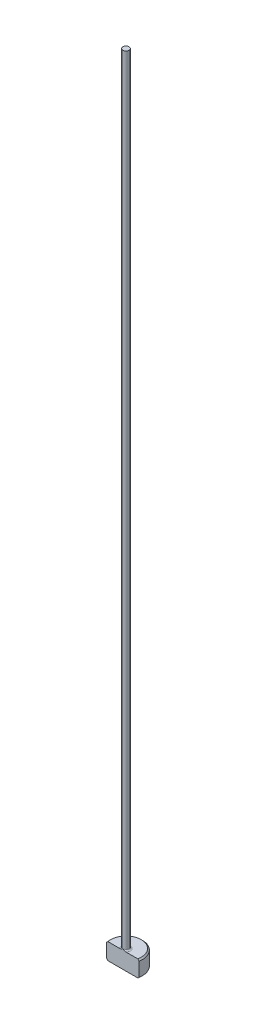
SolidWorks part; units mm, degrees
ref_plane "Front Plane" through (0, 0, 0) normal (0, 0, 1) x (1, 0, 0)
ref_plane "Top Plane" through (0, 0, 0) normal (0, 1, 0) x (1, 0, 0)
ref_plane "Right Plane" through (0, 0, 0) normal (1, 0, 0) x (0, 0, -1)
sketch "Sketch1" plane through (0, 0, 0) normal (0, 0, 1) x (1, 0, 0)
  line L0 (0, 259.9588) -> (0, -15.1925) construction
  line L1 (0, 0) -> (-3.175, 0)
  line L2 (-3.175, 0) -> (-3.175, 3.175)
  line L3 (-3.175, 3.175) -> (-0.5944, 3.175)
  line L4 (-0.5944, 3.175) -> (-0.5944, 152.4)
  line L5 (-0.5944, 152.4) -> (0, 152.4)
  line L6 (0, 152.4) -> (0, 0)
  dimension "L" = 152.4
  dimension "H" = 6.35
  dimension "T" = 3.175
  dimension "D" = 1.1887
revolve "Revolve1" add sketch "Sketch1" angle 360 about L0
chamfer "Chamfer1" distance 0.254 angle 45 2 edges at (0, 3.175, 3.175) (0, 0, 3.175)
fillet "Fillet1" radius 0.254 1 edges at (0, 3.175, 0.5944)
sketch "Sketch2" plane through (0, 0, 0) normal (0, 1, 0) x (1, 0, 0)
  line L0 (-3.1189, -0.5944) -> (3.1189, -0.5944)
  circle A0 centre (0, 0) radius 3.175 construction
  arc A1 (-3.1189, -0.5944) -> (3.1189, -0.5944) centre (0, 0) ccw
  circle A3 centre (0, 0) radius 0.5944 construction
  dimension "D1" = 0
extrude "Key" cut sketch "Sketch2" along normal through all
sketch "Pocket Sketch" plane through (0, 0, 0) normal (0, 0, 1) x (1, 0, 0)
  line L0 (-3.5719, 0) -> (-3.5719, 3.2004)
  line L1 (-3.5719, 3.2004) -> (-1.5548, 3.2004)
  line L2 (-0.7928, 3.9624) -> (-0.7928, 22.225)
  line L3 (-0.7928, 22.225) -> (0, 22.225)
  line L4 (0, 22.225) -> (0, 0)
  line L5 (0, 0) -> (-3.5719, 0)
  line L6 (0, 12.6104) -> (0, -2.4989) construction
  line L7 (-3.175, 2.921) -> (-3.175, 0.254) construction
  line L8 (2.921, 3.175) -> (-2.921, 3.175) construction
  line L9 (-0.5944, 152.4) -> (-0.5944, 3.429) construction
  line L10 (-1.5548, 3.2004) -> (-0.7928, 3.9624)
  point P3 (-0.7928, 3.2004)
  dimension "D1" = 7.1437
  dimension "D2" = 0.3969
  dimension "D3" = 0.0254
  dimension "D4" = 0.1984
  dimension "D5" = 1.5856
  dimension "D6" = 22.225
